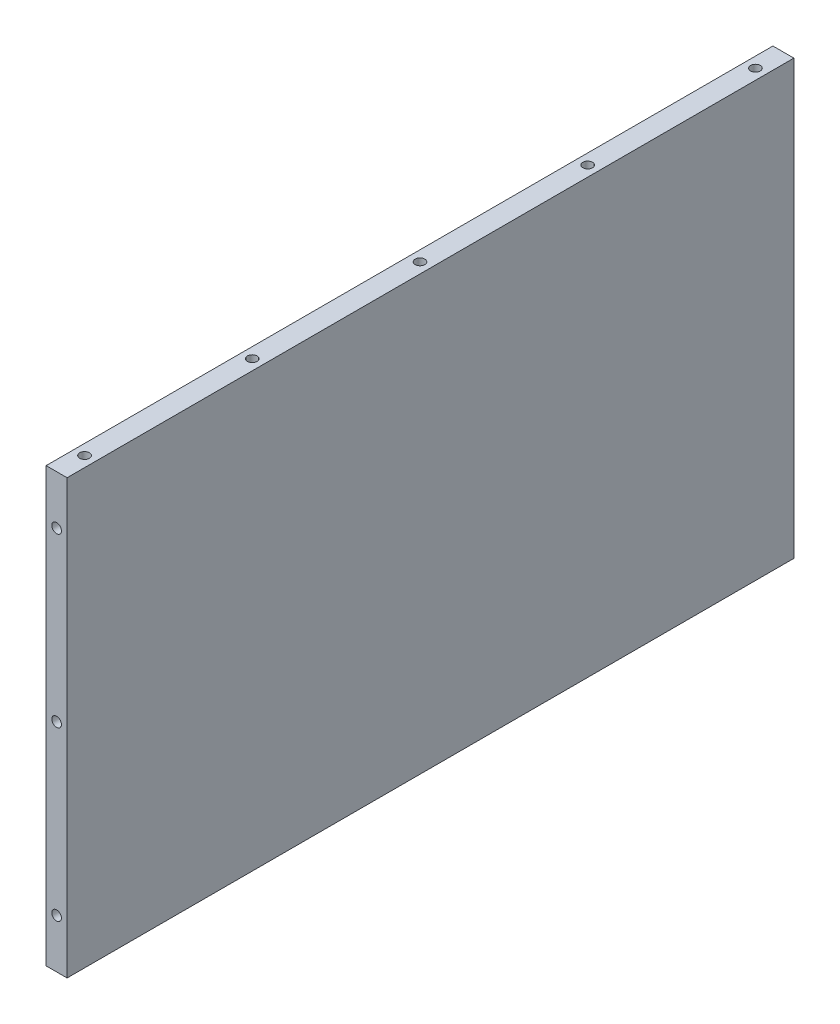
SolidWorks part; units mm, degrees
ref_plane "Front Plane" through (0, 0, 0) normal (0, 0, 1) x (1, 0, 0)
ref_plane "Top Plane" through (0, 0, 0) normal (0, 1, 0) x (1, 0, 0)
ref_plane "Right Plane" through (0, 0, 0) normal (1, 0, 0) x (0, 0, -1)
sketch "Sketch1" plane through (0, 0, 0) normal (1, 0, 0) x (0, 0, -1)
  line L1 (-165.1, 98.425) -> (165.1, 98.425)
  line L2 (-165.1, 98.425) -> (-165.1, -98.425)
  line L3 (-165.1, -98.425) -> (165.1, -98.425)
  line L4 (165.1, 98.425) -> (165.1, -98.425)
  line L5 (-165.1, 98.425) -> (165.1, -98.425) construction
  line L6 (-165.1, -98.425) -> (165.1, 98.425) construction
  point P0 (0, 0)
  dimension "D1" = 196.85
  dimension "D2" = 330.2
extrude "Boss-Extrude1" add sketch "Sketch1" along normal blind 9.525
sketch "Sketch2" plane through (0, 98.425, 0) normal (0, 1, 0) x (1, 0, 0)
  line L0 (4.7625, -165.1) -> (4.7625, 165.1) construction
  line L3 (9.525, -165.1) -> (0, -165.1) construction
  line L5 (9.525, 165.1) -> (0, 165.1) construction
  line L6 (0, 0) -> (9.525, 0) construction
  line L7 (9.525, 165.1) -> (9.525, -165.1) construction
  circle A0 centre (4.7625, 0) radius 2.1971
  circle A1 centre (4.7625, 76.2) radius 2.1971
  circle A2 centre (4.7625, 152.4) radius 2.1971
  circle A4 centre (4.7625, -76.2) radius 2.1971
  circle A5 centre (4.7625, -152.4) radius 2.1971
  dimension "D1" = 4.3942
  dimension "D2" = 3
  dimension "D3" = 3
extrude "Cut-Extrude1" cut sketch "Sketch2" against normal blind 15.24
sketch "Sketch3" plane through (0, -98.425, 0) normal (0, -1, 0) x (-1, 0, 0)
  line L0 (-4.7625, -165.1) -> (-4.7625, 165.1) construction
  line L1 (-9.525, -165.1) -> (0, -165.1) construction
  line L2 (-9.525, 165.1) -> (0, 165.1) construction
  line L3 (0, 0) -> (-9.525, 0) construction
  line L4 (-9.525, -165.1) -> (-9.525, 165.1) construction
  circle A0 centre (-4.7625, 0) radius 2.1971
  circle A1 centre (-4.7625, 76.2) radius 2.1971
  circle A2 centre (-4.7625, 152.4) radius 2.1971
  circle A4 centre (-4.7625, -76.2) radius 2.1971
  circle A5 centre (-4.7625, -152.4) radius 2.1971
  dimension "D1" = 4.3942
  dimension "D2" = 3
  dimension "D3" = 3
extrude "Cut-Extrude2" cut sketch "Sketch3" against normal blind 15.24
sketch "Sketch4" plane through (0, 0, -165.1) normal (0, 0, -1) x (-1, 0, 0)
  line L0 (-4.7625, 98.425) -> (-4.7625, -98.425) construction
  line L1 (-9.525, 98.425) -> (0, 98.425) construction
  line L2 (-9.525, -98.425) -> (0, -98.425) construction
  line L3 (0, 0) -> (-9.525, 0) construction
  line L4 (-9.525, -98.425) -> (-9.525, 98.425) construction
  circle A0 centre (-4.7625, 0) radius 2.1971
  circle A2 centre (-4.7625, 76.2) radius 2.1971
  circle A4 centre (-4.7625, -76.2) radius 2.1971
  circle A5 centre (-4.7625, 38.1) radius 2.1971
  circle A6 centre (-4.7625, -38.1) radius 2.1971
  dimension "D1" = 4.3942
  dimension "D2" = 3
  dimension "D3" = 3
extrude "Cut-Extrude3" cut sketch "Sketch4" against normal blind 15.24
sketch "Sketch5" plane through (0, 0, 165.1) normal (0, 0, 1) x (1, 0, 0)
  line L0 (4.7625, -98.425) -> (4.7625, 98.425) construction
  line L1 (9.525, -98.425) -> (0, -98.425) construction
  line L2 (9.525, 98.425) -> (0, 98.425) construction
  line L3 (0, 0) -> (9.525, 0) construction
  line L4 (9.525, 98.425) -> (9.525, -98.425) construction
  circle A0 centre (4.7625, 0) radius 2.1971
  circle A2 centre (4.7625, 76.2) radius 2.1971
  circle A4 centre (4.7625, -76.2) radius 2.1971
  circle A5 centre (4.7625, -38.1) radius 2.1971
  circle A6 centre (4.7625, 38.1) radius 2.1971
  dimension "D1" = 4.3942
  dimension "D2" = 3
  dimension "D3" = 3
extrude "Cut-Extrude4" cut sketch "Sketch5" against normal blind 15.24
